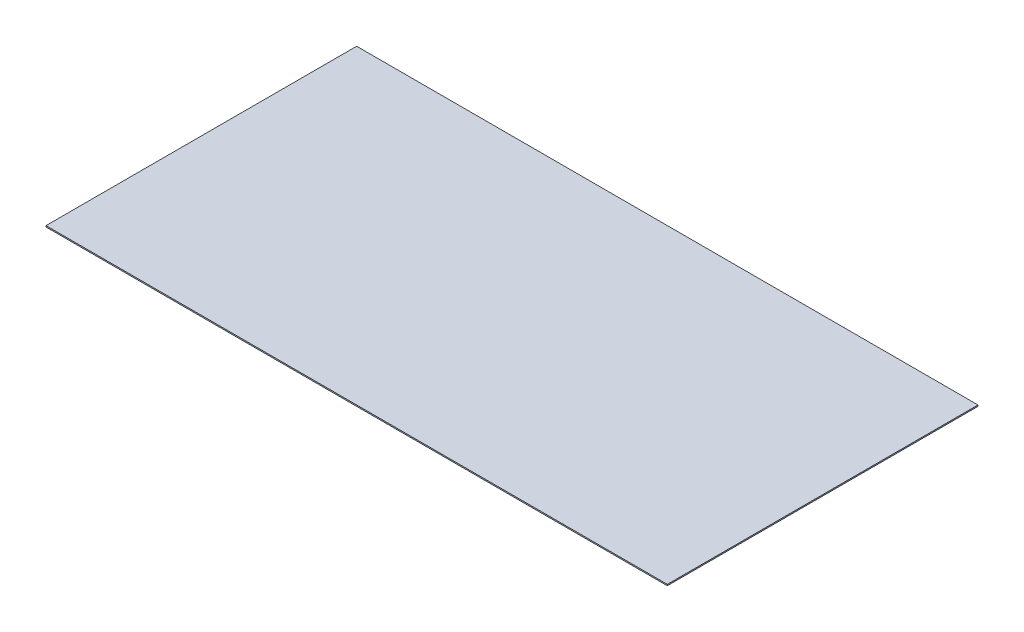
SolidWorks part; units mm, degrees
ref_plane "Plan de face" through (0, 0, 0) normal (0, 0, 1) x (1, 0, 0)
ref_plane "Plan de dessus" through (0, 0, 0) normal (0, 1, 0) x (1, 0, 0)
ref_plane "Plan de droite" through (0, 0, 0) normal (1, 0, 0) x (0, 0, -1)
sketch "Esquisse1" plane through (0, 0, 0) normal (0, 0, 1) x (1, 0, 0)
  line L0 (0, 0) -> (0, -200)
  line L1 (0, -200) -> (100000, -200)
  line L2 (100000, 0) -> (100000, -200)
  line L3 (100000, 0) -> (0, 0)
  dimension "D1" = 100000
  dimension "D2" = 200
  dimension "D5" = 200
  dimension "35000" = 100000
extrude "Boss.-Extru.1" add sketch "Esquisse1" against normal blind 40000 and the other way blind 10000
sketch "Esquisse2" plane through (0, -200, 0) normal (0, 1, 0) x (1, 0, 0)
  line L0 (5000, 15050) -> (5000, 15200)
  line L1 (4900, 14800) -> (5000, 14800)
  line L2 (4900, 14800) -> (4900, 15200)
  line L3 (4900, 15200) -> (5000, 15200)
  line L4 (5000, 14800) -> (5000, 14950)
  line L5 (5000, 15000) -> (4900, 15000) construction
  arc A0 (5000, 14950) -> (5000, 15050) centre (5000, 15000) ccw
  dimension "D1" = 100
  dimension "D2" = 5000
  dimension "D3" = 400
  dimension "D4" = 100
  dimension "D5" = 15000
